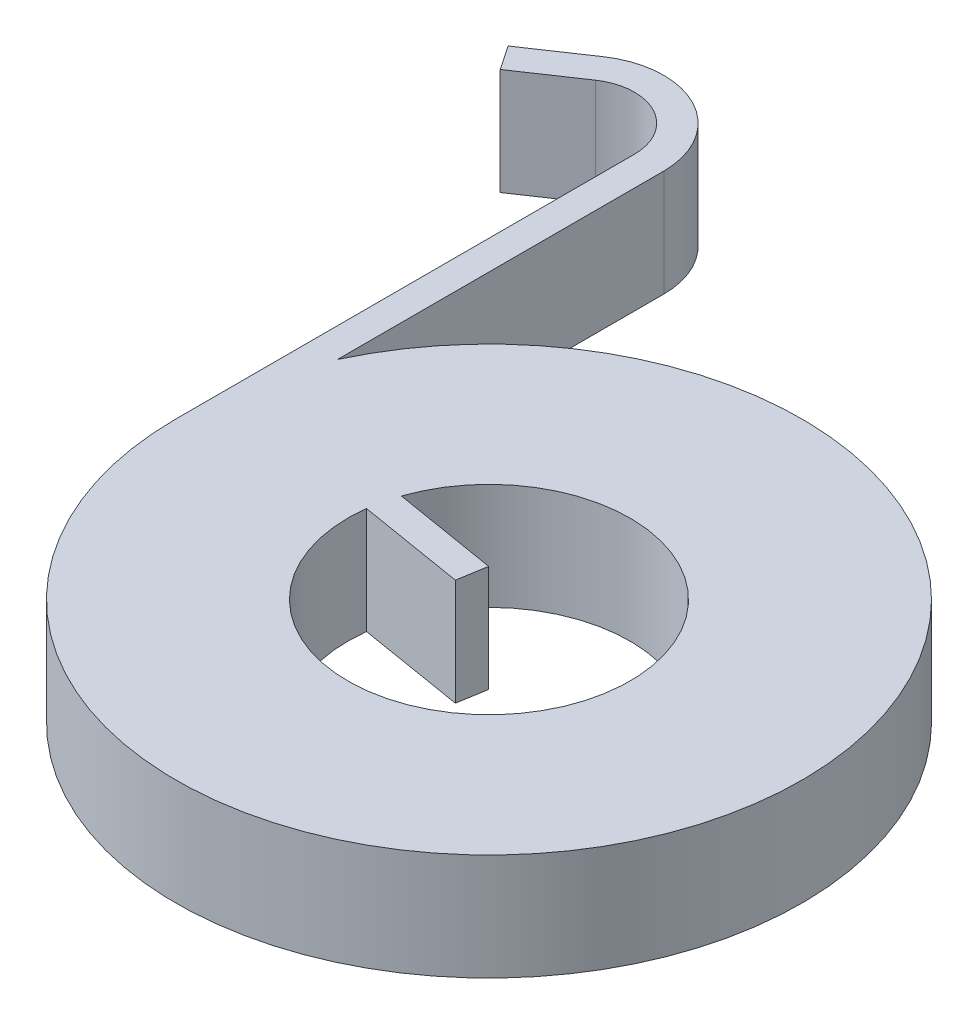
SolidWorks part; units mm, degrees
ref_plane "Front Plane" through (0, 0, 0) normal (0, 0, 1) x (1, 0, 0)
ref_plane "Top Plane" through (0, 0, 0) normal (0, 1, 0) x (1, 0, 0)
ref_plane "Right Plane" through (0, 0, 0) normal (1, 0, 0) x (0, 0, -1)
sketch "Sketch1" plane through (0, 0, 0) normal (0, 1, 0) x (1, 0, 0)
  line L0 (-46.609, 0) -> (-46.609, 68.2851)
  line L1 (-59.0841, 74.9183) -> (-67.5396, 69.215)
  line L2 (-67.5396, 69.215) -> (-69.977, 72.8287)
  line L3 (-61.5215, 78.5319) -> (-69.977, 72.8287)
  line L4 (-42.2501, 68.2851) -> (-42.2501, 19.6805)
  line L5 (-20.8591, 2.6178) -> (-5.0038, 0)
  line L7 (-5.0038, 0) -> (-4.3004, 4.2603)
  line L8 (-19.8813, 6.8328) -> (-4.3004, 4.2603)
  arc A0 (-46.609, 0) -> (-42.2501, 19.6805) centre (0, 0) ccw
  arc A1 (-46.609, 68.2851) -> (-59.0841, 74.9183) centre (-54.61, 68.2851) ccw
  arc A2 (-61.5215, 78.5319) -> (-42.2501, 68.2851) centre (-54.61, 68.2851) cw
  arc A3 (-20.8591, 2.6178) -> (-19.8813, 6.8328) centre (0, 0) ccw
  point P12 (-54.61, 80.645)
  point P14 (46.609, 0)
  point P16 (0, -46.609)
  dimension "D1" = 93.218
  dimension "D2" = 8.001
  dimension "D6" = 42.0454
  dimension "D3" = 127.254
  dimension "D4" = 56
  dimension "D5" = 11.43
  dimension "D7" = 116.586
  dimension "D8" = 80.625
  dimension "D9" = 4.318
  dimension "D10" = 41.6052
  dimension "D11" = 25.7499
extrude "Boss-Extrude1" add sketch "Sketch1" along normal blind 15.875
